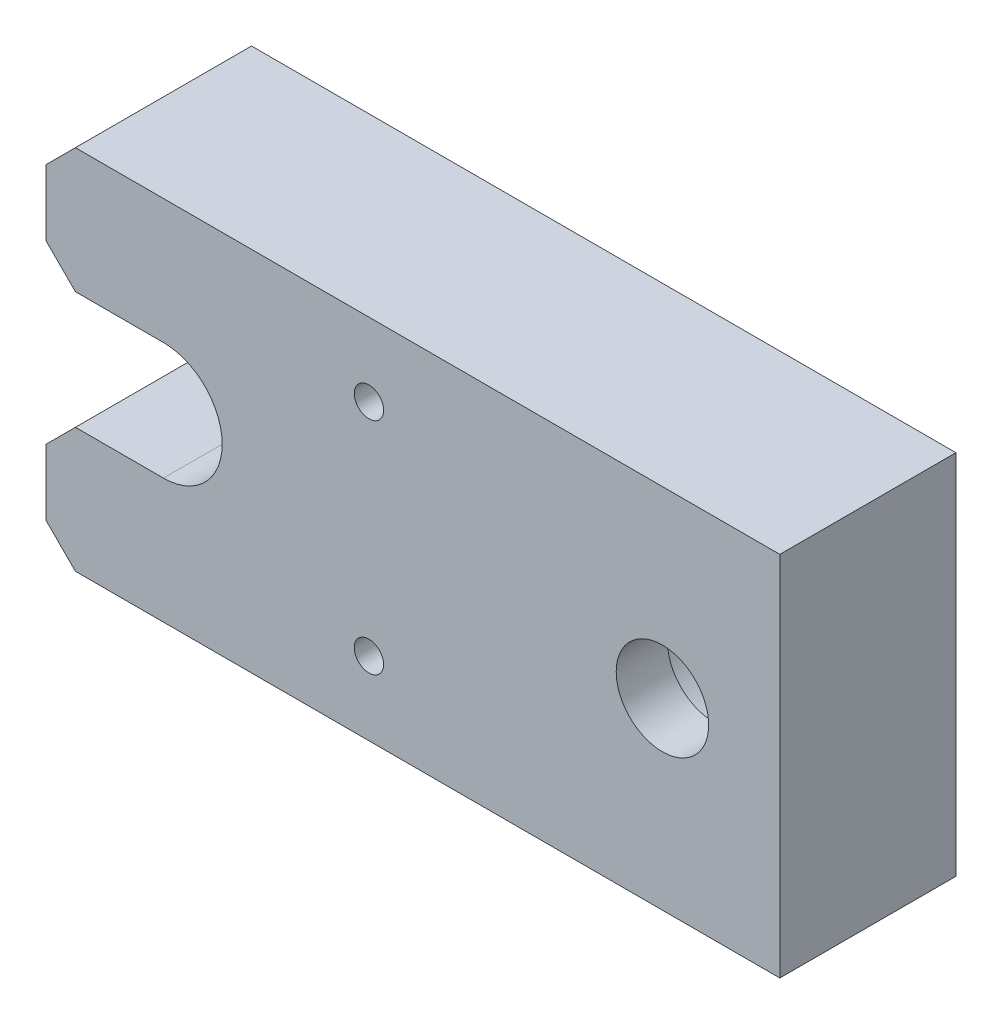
SolidWorks part; units mm, degrees
ref_plane "Plan1" through (0, 0, 0) normal (0, 0, 1) x (1, 0, 0)
ref_plane "Plan2" through (0, 0, 0) normal (0, 1, 0) x (1, 0, 0)
ref_plane "Plan3" through (0, 0, 0) normal (1, 0, 0) x (0, 0, -1)
sketch "Esquisse1" plane through (0, 0, 0) normal (0, 0, 1) x (1, 0, 0)
  line L0 (-1.2633, 12.5) -> (49.5953, 12.5) construction
  line L1 (0, 0) -> (36, 0)
  line L2 (-14, 16.5) -> (-14, 25)
  line L3 (0, 25) -> (36, 25)
  line L4 (36, 0) -> (36, 25)
  line L5 (-14, 8.5) -> (-6, 8.5)
  line L6 (0, 0) -> (-14, 0)
  line L8 (0, 25) -> (-14, 25)
  line L9 (-14, 0) -> (-14, 8.5)
  line L10 (-14, 16.5) -> (-6, 16.5)
  circle A0 centre (8, 20) radius 1
  circle A1 centre (8, 5) radius 1
  circle A2 centre (28, 12.5) radius 3.15
  arc A3 (-6, 8.5) -> (-6, 16.5) centre (-6, 12.5) ccw
  dimension "D1" = 15
  dimension "D2" = 2
  dimension "D4" = 20
  dimension "D5" = 8
  dimension "D6" = 6.3
  dimension "D9" = 4
  dimension "D3" = 25
  dimension "D7" = 8
  dimension "D8" = 36
  dimension "D10" = 50
  dimension "D11" = 8
extrude "Base-Extrusion" add sketch "Esquisse1" along normal blind 12
chamfer "Chanfrein1" distance 2 angle 45 4 edges at (-14, 0, 6) (-14, 8.5, 6) (-14, 16.5, 6) (-14, 25, 6)
sketch "Esquisse2" plane through (0, 0, 0) normal (0, 0, 1) x (1, 0, 0)
  circle A0 centre (8, 20) radius 2.5
  circle A1 centre (8, 5) radius 2.5
  circle A2 centre (8, 20) radius 1 construction
  circle A3 centre (8, 5) radius 1 construction
  circle A4 centre (28, 12.5) radius 5.5
  circle A5 centre (28, 12.5) radius 3.15 construction
  dimension "D2" = 11
extrude "Enlèv. mat.-Extru.1" cut sketch "Esquisse2" along normal blind 8.5
